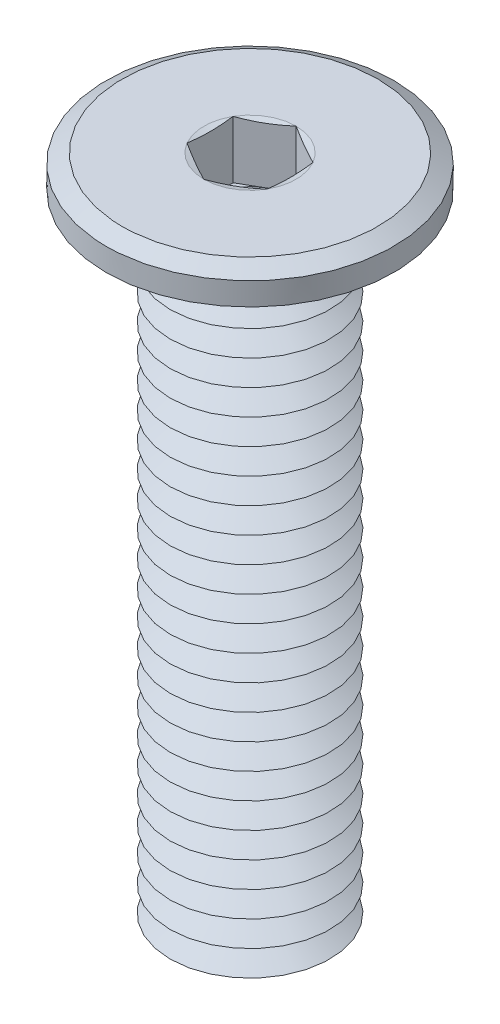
SolidWorks part; units mm, degrees
ref_plane "Front Plane" through (0, 0, 0) normal (0, 0, 1) x (1, 0, 0)
ref_plane "Top Plane" through (0, 0, 0) normal (0, 1, 0) x (1, 0, 0)
ref_plane "Right Plane" through (0, 0, 0) normal (1, 0, 0) x (0, 0, -1)
sketch "Sketch1" plane through (0, 0, 0) normal (0, 1, 0) x (1, 0, 0)
  circle A0 centre (0, 0) radius 4.5
  dimension "D1" = 9
extrude "Boss-Extrude1" add sketch "Sketch1" against normal blind 1
sketch "Sketch2" plane through (0, -1, 0) normal (0, -1, 0) x (1, 0, 0)
  circle A0 centre (0, 0) radius 2.5
  dimension "D1" = 5
extrude "Boss-Extrude2" add sketch "Sketch2" along normal blind 20
sketch "Sketch3" plane through (0, 0, 0) normal (1, 0, 0) x (0, 0, -1)
  line L0 (0, 0.9906) -> (0, -8.2999) construction
sketch "Sketch5" plane through (0, 0, 0) normal (1, 0, 0) x (0, 0, -1)
  line L0 (-2.5, -21.4) -> (-1.8072, -21)
  line L1 (-2.5, -1) -> (-2.5, -21) construction
  line L2 (-1.8072, -21) -> (-2.5, -20.6)
  line L3 (-2.5, -1) -> (-2.5, -21) construction
  line L4 (-2.5, -20.6) -> (-2.5, -21.4)
  line L6 (-2.5, -1) -> (-2.5, -21) construction
  line L7 (-2.5, -1) -> (-2.5, -21) construction
  line L14 (-2.5, -21) -> (2.5, -21) construction
  dimension "D1" = 0.8
revolve "Cut-Revolve1" cut sketch "Sketch5" angle 360 about L0
pattern_linear "LPattern1" count 24 spacing 0.8 along (0, 1, 0) of "Cut-Revolve1"
fillet "Fillet1" radius 0.2 1 edges at (0, -1, -2.5)
chamfer "Chamfer2" distance 0.5 angle 30 1 edges at (0, 0, 4.5)
sketch "Sketch6" plane through (0, 0, 0) normal (0, 1, 0) x (1, 0, 0)
  line L1 (0, 1.4434) -> (-1.25, 0.7217)
  line L2 (-1.25, 0.7217) -> (-1.25, -0.7217)
  line L3 (-1.25, -0.7217) -> (0, -1.4434)
  line L4 (0, -1.4434) -> (1.25, -0.7217)
  line L5 (1.25, -0.7217) -> (1.25, 0.7217)
  line L6 (1.25, 0.7217) -> (0, 1.4434)
  circle A0 centre (0, 0) radius 1.25 construction
  dimension "D1" = 2.5
extrude "Cut-Extrude1" cut sketch "Sketch6" against normal blind 1.8
sketch "Sketch7" plane through (0, -1.8, 0) normal (0, 1, 0) x (1, 0, 0)
  line L0 (-1.25, 0.7217) -> (-1.25, -0.7217) construction
  circle A0 centre (0, 0) radius 1.25
extrude "Cut-Extrude2" cut sketch "Sketch7" against normal through all draft 60
sketch "Sketch8" plane through (0, 0, 0) normal (0, 1, 0) x (1, 0, 0)
  circle A0 centre (0, 0) radius 1.4434
extrude "Cut-Extrude3" cut sketch "Sketch8" against normal through all draft 75
